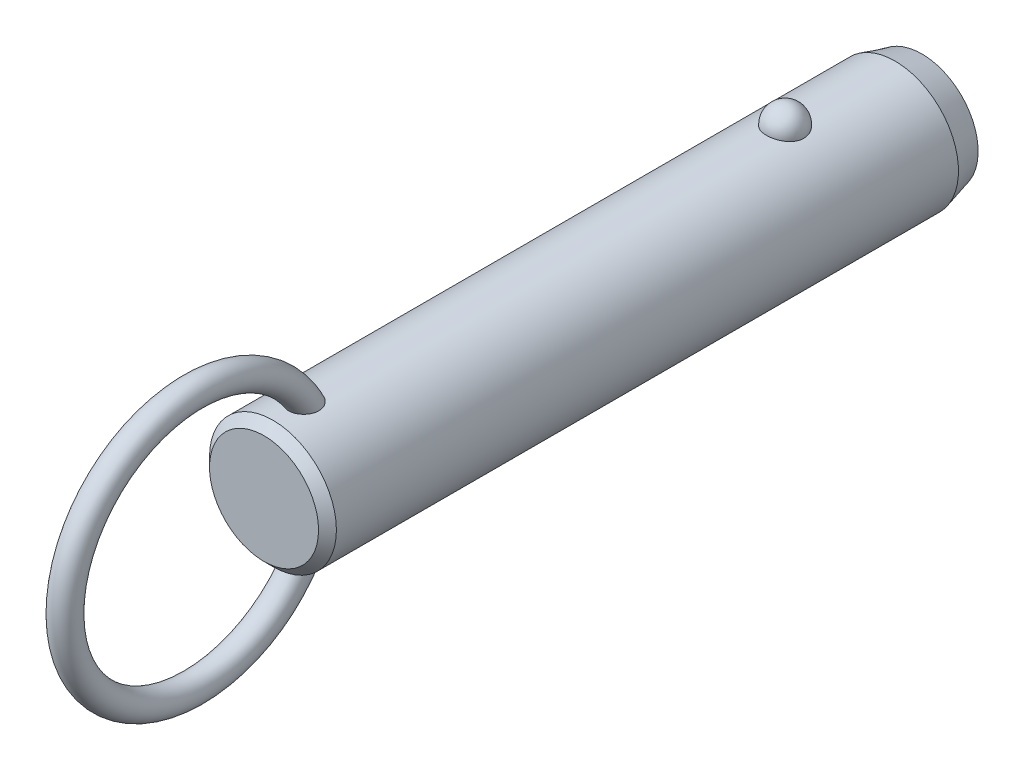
SolidWorks part; units mm, degrees
ref_plane "Front Plane" through (0, 0, 0) normal (0, 0, 1) x (1, 0, 0)
ref_plane "Top Plane" through (0, 0, 0) normal (0, 1, 0) x (1, 0, 0)
ref_plane "Right Plane" through (0, 0, 0) normal (1, 0, 0) x (0, 0, -1)
sketch "Sketch2" plane through (0, 0, 0) normal (0, 0, 1) x (1, 0, 0)
  circle A0 centre (0, 0) radius 7.1
  point P3 (0, 7.1)
  dimension "D1" = 14.2
extrude "Boss-Extrude1" add sketch "Sketch2" along normal blind 48.3
sketch "Sketch3" plane through (0, 0, 0) normal (0, 0, -1) x (-1, 0, 0)
  circle A0 centre (0, 0) radius 7.1
  dimension "D1" = 14.2
extrude "Boss-Extrude2" add sketch "Sketch3" along normal blind 17.4
chamfer "Chamfer1" distance 3 angle 15 1 edges at (-7.1, 0, -17.4)
sketch "Sketch12" plane through (0, 0, 0) normal (1, 0, 0) x (0, 0, -1)
  line L0 (-48.3, 7.1) -> (-48.3, -7.1) construction
  point P0 (-48.3, 0)
sketch "Sketch13" plane through (0, 0, 0) normal (1, 0, 0) x (0, 0, -1)
  circle A0 centre (-64.15, 0) radius 15.85
  point P2 (-48.3, 0)
  dimension "D1" = 31.7
sketch "Sketch14" plane through (0, 0, 0) normal (0, 1, 0) x (1, 0, 0)
  circle A0 centre (0, -49.8) radius 1.5
  point P2 (0, -48.3)
  dimension "D1" = 3
sweep "Sweep1" add profiles "Sketch14" path "Sketch13"
sketch "Sketch15" plane through (0, 0, 48.3) normal (0, 0, 1) x (1, 0, 0)
  circle A0 centre (0, 0) radius 7.1
  dimension "D1" = 14.2
extrude "Boss-Extrude3" add sketch "Sketch15" along normal blind 7.92
chamfer "Chamfer2" distance 1 angle 45 1 edges at (7.1, 0, 56.22)
sketch "Sketch18" plane through (0, 0, 0) normal (1, 0, 0) x (0, 0, -1)
  line L0 (14.4, 7.1) -> (-49.9792, 7.1) construction
  line L1 (2.1, 9.2) -> (2.1, 5)
  line L2 (-49.9792, -7.1) -> (14.4, -7.1) construction
  arc A0 (2.1, 9.2) -> (2.1, 5) centre (2.1, 7.1) ccw
  point P4 (0, 7.1)
  dimension "D1" = 16.3
revolve "Revolve1" add sketch "Sketch18" angle 360 about L1
